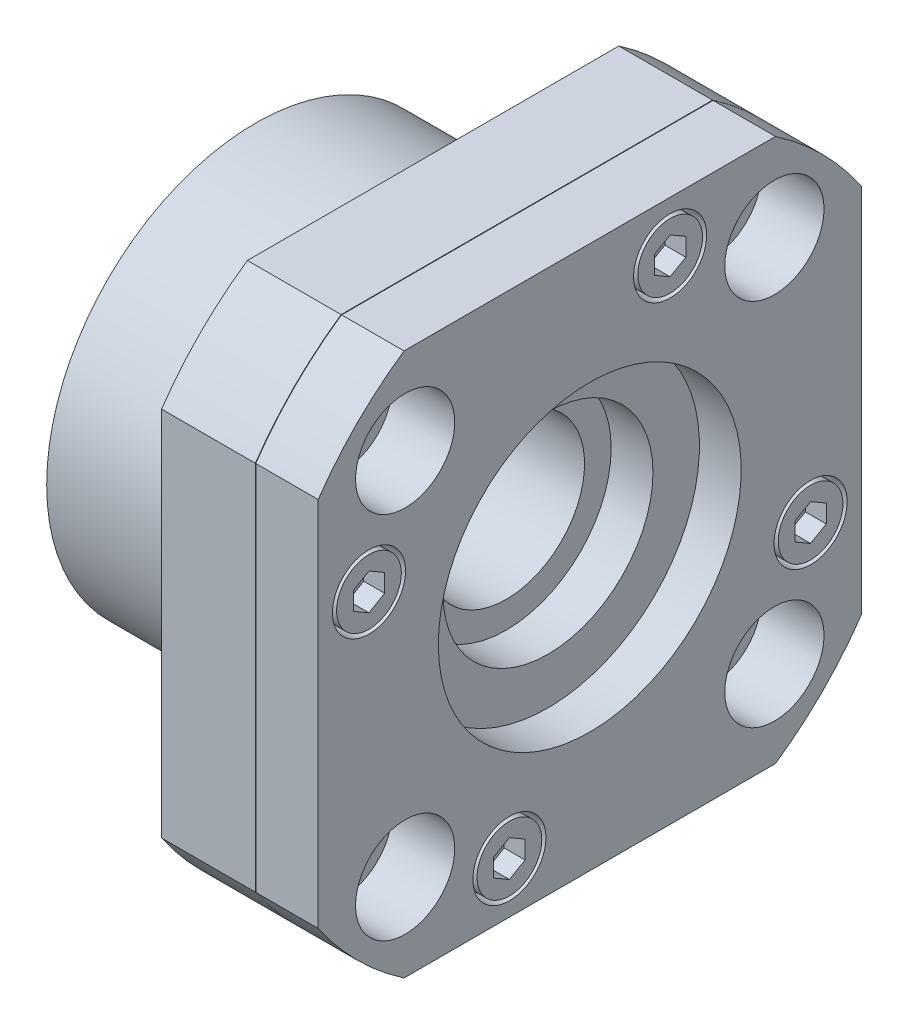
SolidWorks part; units mm, degrees
ref_plane "Front X-Y" through (0, 0, 0) normal (0, 0, 1) x (1, 0, 0)
ref_plane "Top X-Z" through (0, 0, 0) normal (0, 1, 0) x (1, 0, 0)
ref_plane "Right Y-Z" through (0, 0, 0) normal (1, 0, 0) x (0, 0, -1)
ref_plane "Plane1" through (0, 0, 0) normal (0, 0, 1) x (1, 0, 0)
sketch "Sketch1" plane through (0, 0, 0) normal (0, 0, 1) x (1, 0, 0)
  line L0 (0, 0) -> (0, 20)
  line L1 (0, 20) -> (16.7, 20)
  line L2 (17, 20.3) -> (17, 0)
  line L3 (17, 0) -> (0, 0)
  line L4 (17, 0) -> (0, 0) construction
  arc A0 (16.7, 20) -> (17, 20.3) centre (16.7, 20.3) ccw
revolve "Revolve1" add sketch "Sketch1" angle 360 about L4
ref_plane "Plane2" through (17, 0, 0) normal (1, 0, 0) x (0, 0, -1)
sketch "Sketch2" plane through (17, 0, 0) normal (1, 0, 0) x (0, 0, -1)
  line L0 (-17.7834, -26) -> (17.7834, -26)
  line L1 (26, -17.7834) -> (26, 17.7834)
  line L2 (17.7834, 26) -> (-17.7834, 26)
  line L3 (-26, 17.7834) -> (-26, -17.7834)
  arc A0 (-26, -17.7834) -> (-17.7834, -26) centre (0, 0) ccw
  arc A1 (17.7834, -26) -> (26, -17.7834) centre (0, 0) ccw
  arc A2 (26, 17.7834) -> (17.7834, 26) centre (0, 0) ccw
  arc A3 (-17.7834, 26) -> (-26, 17.7834) centre (0, 0) ccw
extrude "Boss-Extrude1" add sketch "Sketch2" along normal blind 15
ref_plane "Plane3" through (0, 0, 0) normal (0, 0, 1) x (1, 0, 0)
sketch "Sketch3" plane through (0, 0, 0) normal (0, 0, 1) x (1, 0, 0)
  line L0 (0, 0) -> (0, 14.5)
  line L1 (0, 14.5) -> (2, 14.5)
  line L2 (2, 14.5) -> (2, 10.05)
  line L3 (2, 10.05) -> (6, 10.05)
  line L4 (6, 10.05) -> (6, 7.5)
  line L5 (6, 7.5) -> (24, 7.5)
  line L6 (24, 7.5) -> (24, 10.05)
  line L7 (24, 10.05) -> (28, 10.05)
  line L8 (28, 10.05) -> (28, 14.5)
  line L9 (28, 14.5) -> (32, 14.5)
  line L10 (32, 14.5) -> (32, 0)
  line L11 (32, 0) -> (0, 0)
  line L12 (32, 0) -> (0, 0) construction
revolve "Cut-Revolve1" cut sketch "Sketch3" angle 360 about L12
ref_plane "Plane4" through (0, -17.6777, 17.6777) normal (0, -0.7071, 0.7071) x (-1, 0, 0)
sketch "Sketch4" plane through (0, -17.6777, 17.6777) normal (0, -0.7071, 0.7071) x (-1, 0, 0)
  line L0 (-17, 0) -> (-17, -2.75)
  line L1 (-17, -2.75) -> (-26, -2.75)
  line L2 (-26, -2.75) -> (-26, -4.75)
  line L3 (-26, -4.75) -> (-32, -4.75)
  line L4 (-32, -4.75) -> (-32, 0)
  line L5 (-32, 0) -> (-17, 0)
  line L6 (-32, 0) -> (-17, 0) construction
revolve "Cut-Revolve2" cut sketch "Sketch4" angle 360 about L6
ref_plane "Plane5" through (0, 0, 0) normal (0, -0.7071, 0.7071) x (1, 0, 0)
sketch "Sketch5" plane through (0, 0, 0) normal (0, -0.7071, 0.7071) x (1, 0, 0)
  line L0 (17, 25) -> (17, 27.75)
  line L1 (17, 27.75) -> (26, 27.75)
  line L2 (26, 27.75) -> (26, 29.75)
  line L3 (26, 29.75) -> (32, 29.75)
  line L4 (32, 29.75) -> (32, 25)
  line L5 (32, 25) -> (17, 25)
  line L6 (32, 25) -> (17, 25) construction
revolve "Cut-Revolve3" cut sketch "Sketch5" angle 360 about L6
ref_plane "Plane6" through (0, 17.6777, -17.6777) normal (0, -0.7071, 0.7071) x (1, 0, 0)
sketch "Sketch6" plane through (0, 17.6777, -17.6777) normal (0, -0.7071, 0.7071) x (1, 0, 0)
  line L0 (17, 0) -> (17, 2.75)
  line L1 (17, 2.75) -> (26, 2.75)
  line L2 (26, 2.75) -> (26, 4.75)
  line L3 (26, 4.75) -> (32, 4.75)
  line L4 (32, 4.75) -> (32, 0)
  line L5 (32, 0) -> (17, 0)
  line L6 (32, 0) -> (17, 0) construction
revolve "Cut-Revolve4" cut sketch "Sketch6" angle 360 about L6
ref_plane "Plane7" through (0, 0, 0) normal (0, -0.7071, 0.7071) x (1, 0, 0)
sketch "Sketch7" plane through (0, 0, 0) normal (0, -0.7071, 0.7071) x (1, 0, 0)
  line L0 (17, -25) -> (17, -22.25)
  line L1 (17, -22.25) -> (26, -22.25)
  line L2 (26, -22.25) -> (26, -20.25)
  line L3 (26, -20.25) -> (32, -20.25)
  line L4 (32, -20.25) -> (32, -25)
  line L5 (32, -25) -> (17, -25)
  line L6 (32, -25) -> (17, -25) construction
revolve "Cut-Revolve5" cut sketch "Sketch7" angle 360 about L6
ref_plane "Plane8" through (26, 0, 0) normal (1, 0, 0) x (0, 0, -1)
sketch "Sketch8" plane through (26, 0, 0) normal (1, 0, 0) x (0, 0, -1)
  line L0 (-17.7834, -26) -> (17.7834, -26)
  line L1 (26, -17.7834) -> (26, 17.7834)
  line L2 (17.7834, 26) -> (-17.7834, 26)
  line L3 (-26, 17.7834) -> (-26, -17.7834)
  line L4 (-17.7679, -25.95) -> (17.7679, -25.95)
  line L5 (25.95, -17.7679) -> (25.95, 17.7679)
  line L6 (17.7679, 25.95) -> (-17.7679, 25.95)
  line L7 (-25.95, 17.7679) -> (-25.95, -17.7679)
  arc A0 (-26, -17.7834) -> (-17.7834, -26) centre (0, 0) ccw
  arc A1 (17.7834, -26) -> (26, -17.7834) centre (0, 0) ccw
  arc A2 (26, 17.7834) -> (17.7834, 26) centre (0, 0) ccw
  arc A3 (-17.7834, 26) -> (-26, 17.7834) centre (0, 0) ccw
  arc A4 (-25.95, -17.7679) -> (-17.7679, -25.95) centre (0, 0) ccw
  arc A5 (17.7679, -25.95) -> (25.95, -17.7679) centre (0, 0) ccw
  arc A6 (25.95, 17.7679) -> (17.7679, 25.95) centre (0, 0) ccw
  arc A7 (-17.7679, 25.95) -> (-25.95, 17.7679) centre (0, 0) ccw
extrude "Cut-Extrude1" cut sketch "Sketch8" against normal blind 0.025 and the other way blind 0.025
ref_plane "Plane9" through (32, 0, 0) normal (1, 0, 0) x (0, 0, -1)
sketch "Sketch9" plane through (32, 0, 0) normal (1, 0, 0) x (0, 0, -1)
  circle A0 centre (-21.1431, 7.6955) radius 3.5
  circle A1 centre (-21.1431, 7.6955) radius 3.1
extrude "Cut-Extrude2" cut sketch "Sketch9" against normal blind 4
ref_plane "Plane10" through (32, 0, 0) normal (1, 0, 0) x (0, 0, -1)
sketch "Sketch10" plane through (32, 0, 0) normal (1, 0, 0) x (0, 0, -1)
  circle A0 centre (-7.6955, -21.1431) radius 3.5
  circle A1 centre (-7.6955, -21.1431) radius 3.1
extrude "Cut-Extrude3" cut sketch "Sketch10" against normal blind 4
ref_plane "Plane11" through (32, 0, 0) normal (1, 0, 0) x (0, 0, -1)
sketch "Sketch11" plane through (32, 0, 0) normal (1, 0, 0) x (0, 0, -1)
  circle A0 centre (21.1431, -7.6955) radius 3.5
  circle A1 centre (21.1431, -7.6955) radius 3.1
extrude "Cut-Extrude4" cut sketch "Sketch11" against normal blind 4
ref_plane "Plane12" through (32, 0, 0) normal (1, 0, 0) x (0, 0, -1)
sketch "Sketch12" plane through (32, 0, 0) normal (1, 0, 0) x (0, 0, -1)
  circle A0 centre (7.6955, 21.1431) radius 3.5
  circle A1 centre (7.6955, 21.1431) radius 3.1
extrude "Cut-Extrude5" cut sketch "Sketch12" against normal blind 4
ref_plane "Plane13" through (32, 0, 0) normal (1, 0, 0) x (0, 0, -1)
sketch "Sketch13" plane through (32, 0, 0) normal (1, 0, 0) x (0, 0, -1)
  line L0 (-22.6431, 8.5615) -> (-22.6431, 6.8294)
  line L1 (-22.6431, 6.8294) -> (-21.1431, 5.9634)
  line L2 (-21.1431, 5.9634) -> (-19.6431, 6.8294)
  line L3 (-19.6431, 6.8294) -> (-19.6431, 8.5615)
  line L4 (-19.6431, 8.5615) -> (-21.1431, 9.4275)
  line L5 (-21.1431, 9.4275) -> (-22.6431, 8.5615)
extrude "Cut-Extrude6" cut sketch "Sketch13" against normal blind 2
ref_plane "Plane14" through (32, 0, 0) normal (1, 0, 0) x (0, 0, -1)
sketch "Sketch14" plane through (32, 0, 0) normal (1, 0, 0) x (0, 0, -1)
  line L0 (-9.1955, -20.2771) -> (-9.1955, -22.0091)
  line L1 (-9.1955, -22.0091) -> (-7.6955, -22.8751)
  line L2 (-7.6955, -22.8751) -> (-6.1955, -22.0091)
  line L3 (-6.1955, -22.0091) -> (-6.1955, -20.2771)
  line L4 (-6.1955, -20.2771) -> (-7.6955, -19.411)
  line L5 (-7.6955, -19.411) -> (-9.1955, -20.2771)
extrude "Cut-Extrude7" cut sketch "Sketch14" against normal blind 2
ref_plane "Plane15" through (32, 0, 0) normal (1, 0, 0) x (0, 0, -1)
sketch "Sketch15" plane through (32, 0, 0) normal (1, 0, 0) x (0, 0, -1)
  line L0 (19.6431, -6.8294) -> (19.6431, -8.5615)
  line L1 (19.6431, -8.5615) -> (21.1431, -9.4275)
  line L2 (21.1431, -9.4275) -> (22.6431, -8.5615)
  line L3 (22.6431, -8.5615) -> (22.6431, -6.8294)
  line L4 (22.6431, -6.8294) -> (21.1431, -5.9634)
  line L5 (21.1431, -5.9634) -> (19.6431, -6.8294)
extrude "Cut-Extrude8" cut sketch "Sketch15" against normal blind 2
ref_plane "Plane16" through (32, 0, 0) normal (1, 0, 0) x (0, 0, -1)
sketch "Sketch16" plane through (32, 0, 0) normal (1, 0, 0) x (0, 0, -1)
  line L0 (6.1955, 22.0091) -> (6.1955, 20.2771)
  line L1 (6.1955, 20.2771) -> (7.6955, 19.411)
  line L2 (7.6955, 19.411) -> (9.1955, 20.2771)
  line L3 (9.1955, 20.2771) -> (9.1955, 22.0091)
  line L4 (9.1955, 22.0091) -> (7.6955, 22.8751)
  line L5 (7.6955, 22.8751) -> (6.1955, 22.0091)
extrude "Cut-Extrude9" cut sketch "Sketch16" against normal blind 2
